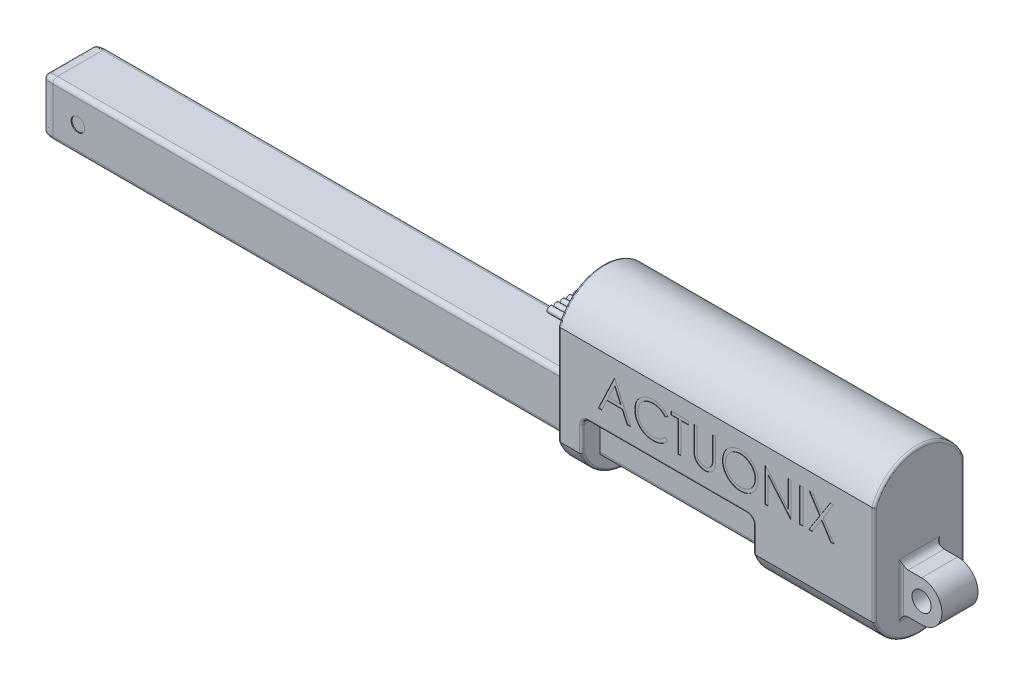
SolidWorks part; units mm, degrees
ref_plane "Front Plane" through (0, 0, 0) normal (0, 0, 1) x (1, 0, 0)
ref_plane "Top Plane" through (0, 0, 0) normal (0, 1, 0) x (1, 0, 0)
ref_plane "Right Plane" through (0, 0, 0) normal (1, 0, 0) x (0, 0, -1)
sketch "Sketch1" plane through (0, 0, 0) normal (0, 0, 1) x (1, 0, 0)
  line L0 (39.5, -12) -> (35, -12)
  line L1 (-35, 18) -> (35, 18)
  line L2 (-35, 18) -> (-35, -18)
  line L3 (-35, -18) -> (35, -18)
  line L4 (35, 18) -> (35, -3)
  line L5 (-35, 18) -> (35, -18) construction
  line L6 (-35, -18) -> (35, 18) construction
  line L7 (39.5, -3) -> (35, -3)
  line L8 (35, -12) -> (35, -18)
  circle A0 centre (39.5, -7.5) radius 2.125
  arc A1 (39.5, -12) -> (39.5, -3) centre (39.5, -7.5) ccw
  point P0 (0, 0)
  point P9 (44, -7.5)
  dimension "D3" = 4.25
  dimension "D5" = 4.5
  dimension "D1" = 70
  dimension "D2" = 36
  dimension "D4" = 10.5
  dimension "D6" = 4.5
extrude "Boss-Extrude1" add sketch "Sketch1" along normal mid plane 20
sketch "Sketch2" plane through (0, 18, 0) normal (0, 1, 0) x (1, 0, 0)
  line L1 (35, -10) -> (44, -10)
  line L2 (35, -10) -> (35, 10)
  line L3 (35, 10) -> (44, 10)
  line L4 (44, -10) -> (44, 10)
  line L5 (35, -4) -> (44, -4)
  line L6 (35, -4) -> (35, 4)
  line L7 (35, 4) -> (44, 4)
  line L8 (44, -4) -> (44, 4)
  line L9 (35, -4) -> (44, 4) construction
  line L10 (35, 4) -> (44, -4) construction
  point P6 (39.5, 0)
  point P11 (35, 0)
  dimension "D1" = 8
extrude "Cut-Extrude1" cut sketch "Sketch2" against normal through all contours L5 L1 L4 M12 | L7 L4 L3 M12
sketch "Sketch3" plane through (0, 0, 10) normal (0, 0, 1) x (1, 0, 0)
  line L1 (-35, -18) -> (35, -18) construction
  line L2 (-29.75, -18) -> (-29.75, -13.5)
  line L3 (-29.75, -13.5) -> (8.25, -13.5)
  line L5 (8.25, -13.5) -> (8.25, -18)
  line L6 (-29.75, -18) -> (8.25, -18)
  line L7 (-35, 18) -> (-35, -18) construction
  dimension "D1" = 5.25
  dimension "D2" = 38
  dimension "D3" = 4.5
extrude "Cut-Extrude2" cut sketch "Sketch3" against normal through all contours L6 L5 L3 L2
sketch "Sketch4" plane through (0, -13.5, 0) normal (0, -1, 0) x (1, 0, 0)
  line L0 (8.25, -10) -> (8.25, 10) construction
  line L1 (-29.75, -10) -> (8.25, -10)
  line L2 (-29.75, -10) -> (-29.75, -6)
  line L3 (-29.75, -6) -> (8.25, -6)
  line L4 (8.25, -10) -> (8.25, -6)
  line L5 (-29.75, 0) -> (8.25, 0) construction
  line L6 (-29.75, 10) -> (8.25, 10)
  line L7 (-29.75, 10) -> (-29.75, 6)
  line L8 (-29.75, 6) -> (8.25, 6)
  line L9 (8.25, 10) -> (8.25, 6)
  line L10 (-29.75, -10) -> (-29.75, 10) construction
  dimension "D1" = 12
extrude "Cut-Extrude3" cut sketch "Sketch4" against normal blind 9.5
sketch "Sketch5" plane through (-35, 0, 0) normal (-1, 0, 0) x (0, 0, 1)
  line L0 (-6, -13.5) -> (6, -13.5) construction
  line L1 (-6, -13.5) -> (6, -13.5) construction
  line L2 (-6, -4) -> (-6, -13.5) construction
  line L3 (6, -4) -> (6, -13.5) construction
  line L4 (-6, -4) -> (-6, -13.5) construction
  line L5 (6, -4) -> (6, -13.5) construction
  line L6 (-6, -4) -> (-6, -1.5) construction
  line L7 (-6, -1.5) -> (6, -1.5) construction
  line L8 (6, -1.5) -> (6, -4) construction
  line L9 (-5.625, 3.375) -> (1.125, 3.375) construction
  line L10 (-5.625, 5.25) -> (1.125, 5.25)
  line L11 (-5.625, 1.5) -> (1.125, 1.5)
  line L12 (0, 18) -> (0, -1.5) construction
  line L13 (10, 18) -> (-10, 18) construction
  arc A0 (-5.625, 5.25) -> (-5.625, 1.5) centre (-5.625, 3.375) ccw
  arc A1 (1.125, 1.5) -> (1.125, 5.25) centre (1.125, 3.375) ccw
  point P8 (-2.25, 3.375)
  point P17 (3, 3.375)
  point P18 (-7.5, 3.375)
  dimension "D1" = 12
  dimension "D2" = 3
  dimension "D3" = 3
  dimension "D4" = 3.75
  dimension "D5" = 10.5
sketch "Sketch6" plane through (35, 0, 0) normal (1, 0, 0) x (0, 0, -1)
  line L0 (0, 18) -> (0, -3.0686) construction
  line L1 (-10, 18) -> (10, 18) construction
  line L2 (-10, 18) -> (-10, 11) construction
  line L3 (-10, -18) -> (-10, 18) construction
  line L4 (10, -18) -> (10, 18) construction
  arc A0 (-10, 11) -> (10, 11) centre (0, 7.3571) cw
  dimension "D1" = 7
extrude "Cut-Extrude4" cut sketch "Sketch6" against normal through all and the other way through all contours A0 M6 M5 | A0 M5 M8
sketch "Sketch7" plane through (35, 0, 0) normal (1, 0, 0) x (0, 0, -1)
  line L0 (0, 0) -> (-10, 0) construction
  line L1 (-10, -18) -> (-10, 11) construction
  line L2 (10, -18) -> (10, 11) construction
  line L4 (-10, -11) -> (-10, -18)
  line L5 (-10, -18) -> (10, -18)
  line L6 (10, -18) -> (10, -11)
  arc A0 (10, 11) -> (-10, 11) centre (0, 7.3571) ccw construction
  arc A2 (10, -11) -> (-10, -11) centre (0, -7.3571) cw
extrude "Cut-Extrude5" cut sketch "Sketch7" against normal through all contours A2 M8 M7 | A2 L5 M5
extrude "Boss-Extrude2" add sketch "Sketch5" along normal blind 4.31 separate body
sketch "Sketch8" plane through (-39.31, 0, 0) normal (-1, 0, 0) x (0, 0, 1)
  circle A0 centre (-5.625, 3.375) radius 0.675
  circle A1 centre (-4.225, 3.375) radius 0.675
  circle A2 centre (-2.825, 3.375) radius 0.675
  circle A3 centre (-1.425, 3.375) radius 0.675
  circle A4 centre (-0.025, 3.375) radius 0.675
  dimension "D1" = 1.35
  dimension "D2" = 1.4
  dimension "D3" = 1.4
  dimension "D4" = 1.4
  dimension "D5" = 1.4
extrude "Boss-Extrude3" add sketch "Sketch8" along normal blind 7.5 separate body
sketch "Sketch9" plane through (-35, 0, 0) normal (-1, 0, 0) x (0, 0, 1)
  line L0 (-6, -4) -> (-6, -1.5) construction
  line L1 (-6, -4) -> (-6, -13.5) construction
  line L2 (-6, -13.5) -> (6, -13.5) construction
  line L3 (6, -4) -> (6, -13.5) construction
  line L4 (6, -1.5) -> (6, -4) construction
  line L5 (-6, -1.5) -> (6, -1.5) construction
  line L6 (-6, -4) -> (-6, -2.5)
  line L7 (-6, -4) -> (-6, -12.5)
  line L8 (-5, -13.5) -> (5, -13.5)
  line L9 (6, -4) -> (6, -12.5)
  line L10 (6, -2.5) -> (6, -4)
  line L11 (-5, -1.5) -> (5, -1.5)
  arc A0 (-6, -12.5) -> (-5, -13.5) centre (-5, -12.5) ccw
  arc A1 (5, -13.5) -> (6, -12.5) centre (5, -12.5) ccw
  arc A2 (6, -2.5) -> (5, -1.5) centre (5, -2.5) ccw
  arc A3 (-6, -2.5) -> (-5, -1.5) centre (-5, -2.5) cw
  dimension "D1" = 1
extrude "Boss-Extrude4" add sketch "Sketch9" along normal blind 117.9 separate body
sketch "Sketch10" plane through (-152.9, 0, 0) normal (-1, 0, 0) x (0, 0, 1)
  line L0 (0, -1.5) -> (0, -13.5) construction
  line L1 (5, -1.5) -> (-5, -1.5) construction
  line L2 (-5, -13.5) -> (5, -13.5) construction
  circle A0 centre (0, -7.5) radius 4.5
  dimension "D1" = 9
extrude "Cut-Extrude6" cut sketch "Sketch10" against normal blind 50
sketch "Sketch12" plane through (0, 0, 10) normal (0, 0, 1) x (1, 0, 0)
  line L0 (-35, -0.25) -> (35, -0.25) construction
  line L1 (-35, 11) -> (-35, -11) construction
  line L2 (35, -11) -> (35, 11) construction
  line L3 (8.25, -4) -> (-29.75, -4) construction
  text T0 "ACTUONIX" font "Century Gothic" height 7.5
  dimension "D1" = 3.75
extrude "Cut-Extrude7" cut sketch "Sketch12" against normal blind 0.1
sketch "Sketch13" plane through (0, 0, -10) normal (0, 0, -1) x (-1, 0, 0)
  line L0 (35, -0.25) -> (-35, -0.25) construction
  line L1 (35, -0.25) -> (-35, -0.25) construction
  line L2 (-35, 7.25) -> (35, 7.25) construction
  line L3 (-35, -11) -> (-35, 11) construction
  line L4 (35, 11) -> (35, -11) construction
  text T0 "ACTUONIX" font "Century Gothic" height 7.5
  dimension "D1" = 7.5
extrude "Cut-Extrude8" cut sketch "Sketch13" against normal blind 0.1
fillet "Fillet1" radius 2 8 edges at (-152.9, -13.5, 0) (-152.9, -7.5, 6) (-152.9, -1.5, 0) (-152.9, -7.5, -6) (-152.9, -1.7929, 5.7071) (-152.9, -13.2071, 5.7071) (-152.9, -1.7929, -5.7071) (-152.9, -13.2071, -5.7071)
sketch "Sketch14" plane through (0, 0, 6) normal (0, 0, 1) x (1, 0, 0)
  line L0 (-150.9, -7.5) -> (-35, -7.5) construction
  line L1 (-150.9, -2.5) -> (-150.9, -12.5) construction
  line L2 (-35, -12.5) -> (-35, -2.5) construction
  circle A0 centre (-145.4, -7.5) radius 1.5
  dimension "D1" = 3
  dimension "D2" = 5.5
extrude "Cut-Extrude9" cut sketch "Sketch14" against normal blind 0.2
sketch "Sketch15" plane through (0, 0, -6) normal (0, 0, -1) x (-1, 0, 0)
  circle A1 centre (145.4, -7.5) radius 1.5
  circle A2 centre (145.4, -7.5) radius 1.5
  dimension "D1" = 0
extrude "Cut-Extrude10" cut sketch "Sketch15" against normal blind 0.2
fillet "Fillet2" radius 1.5 4 edges at (-29.75, -4, 8) (-29.75, -4, -8) (8.25, -4, -8) (8.25, -4, 8)
fillet "Fillet3" radius 1.5 2 edges at (35, -3, 0) (35, -12, 0)
fillet "Fillet4" radius 0.5 2 edges at (35, -7.5, 4) (35, -7.5, -4)
fillet "Fillet5" radius 1 2 edges at (-10.75, -13.5, -6) (-10.75, -13.5, 6)
fillet "Fillet6" radius 0.5 20 edges at (-29.75, -8.25, 10) (-29.3107, -4.4393, 10) (-10.75, -4, 10) (7.8107, -4.4393, 10) (8.25, -8.25, 10) (8.25, -18, 0) (7.8107, -4.4393, -10) (8.25, -8.25, -10) (-10.75, -4, -10) (-29.3107, -4.4393, -10) (-29.75, -8.25, -10) (-29.75, -18, 0) (35, 0, 10) (35, 18, 0) (35, 0, -10) (35, -18, 0) (-35, -18, 0) (-35, 0, -10) (-35, 18, 0) (-35, 0, 10)
